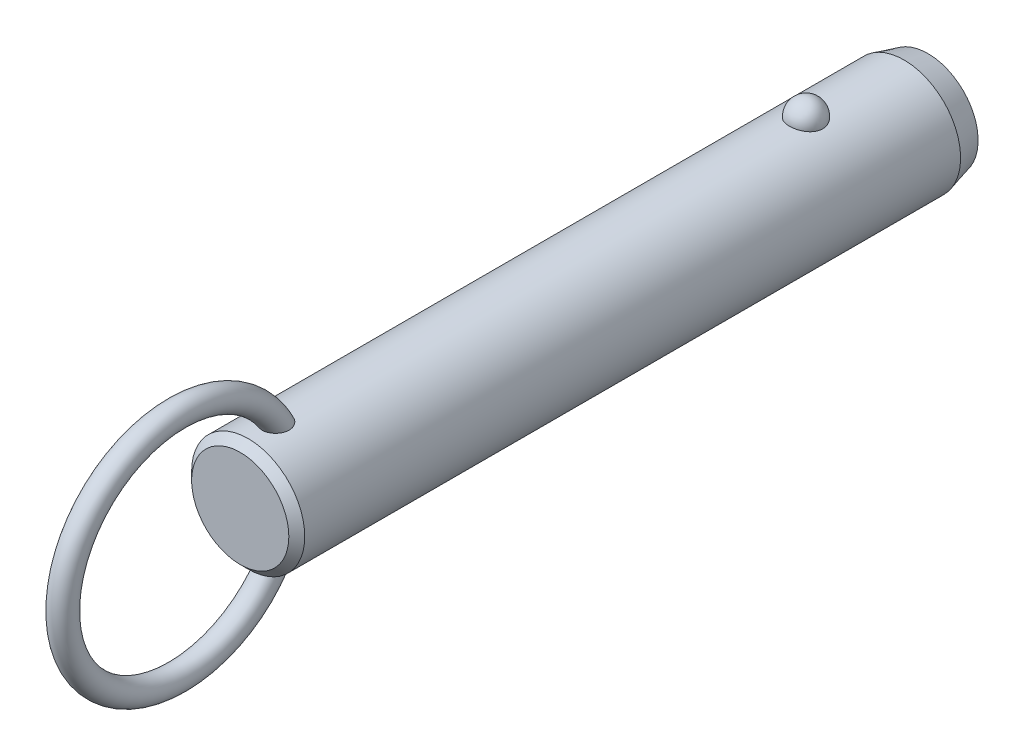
SolidWorks part; units mm, degrees
ref_plane "Front Plane" through (0, 0, 0) normal (0, 0, 1) x (1, 0, 0)
ref_plane "Top Plane" through (0, 0, 0) normal (0, 1, 0) x (1, 0, 0)
ref_plane "Right Plane" through (0, 0, 0) normal (1, 0, 0) x (0, 0, -1)
sketch "Sketch2" plane through (0, 0, 0) normal (0, 0, 1) x (1, 0, 0)
  circle A0 centre (0, 0) radius 7.1
  point P3 (0, 7.1)
  dimension "D1" = 14.2
extrude "Boss-Extrude1" add sketch "Sketch2" along normal blind 61
sketch "Sketch3" plane through (0, 0, 0) normal (0, 0, -1) x (-1, 0, 0)
  circle A0 centre (0, 0) radius 7.1
  dimension "D1" = 14.2
extrude "Boss-Extrude2" add sketch "Sketch3" along normal blind 17.4
chamfer "Chamfer1" distance 3 angle 15 1 edges at (-7.1, 0, -17.4)
sketch "Sketch12" plane through (0, 0, 0) normal (1, 0, 0) x (0, 0, -1)
  line L0 (-61, 7.1) -> (-61, -7.1) construction
  point P0 (-61, 0)
sketch "Sketch13" plane through (0, 0, 0) normal (1, 0, 0) x (0, 0, -1)
  circle A0 centre (-76.85, 0) radius 15.85
  point P2 (-61, 0)
  dimension "D1" = 31.7
sketch "Sketch14" plane through (0, 0, 0) normal (0, 1, 0) x (1, 0, 0)
  circle A0 centre (0, -62.5) radius 1.5
  point P2 (0, -61)
  dimension "D1" = 3
sweep "Sweep1" add profiles "Sketch14" path "Sketch13"
sketch "Sketch15" plane through (0, 0, 61) normal (0, 0, 1) x (1, 0, 0)
  circle A0 centre (0, 0) radius 7.1
  dimension "D1" = 14.2
extrude "Boss-Extrude3" add sketch "Sketch15" along normal blind 7.92
chamfer "Chamfer2" distance 1 angle 45 1 edges at (7.1, 0, 68.92)
sketch "Sketch18" plane through (0, 0, 0) normal (1, 0, 0) x (0, 0, -1)
  line L0 (14.4, 7.1) -> (-62.6792, 7.1) construction
  line L1 (2.1, 9.2) -> (2.1, 5)
  line L2 (-62.6792, -7.1) -> (14.4, -7.1) construction
  arc A0 (2.1, 9.2) -> (2.1, 5) centre (2.1, 7.1) ccw
  point P4 (0, 7.1)
  dimension "D1" = 16.3
revolve "Revolve1" add sketch "Sketch18" angle 360 about L1
